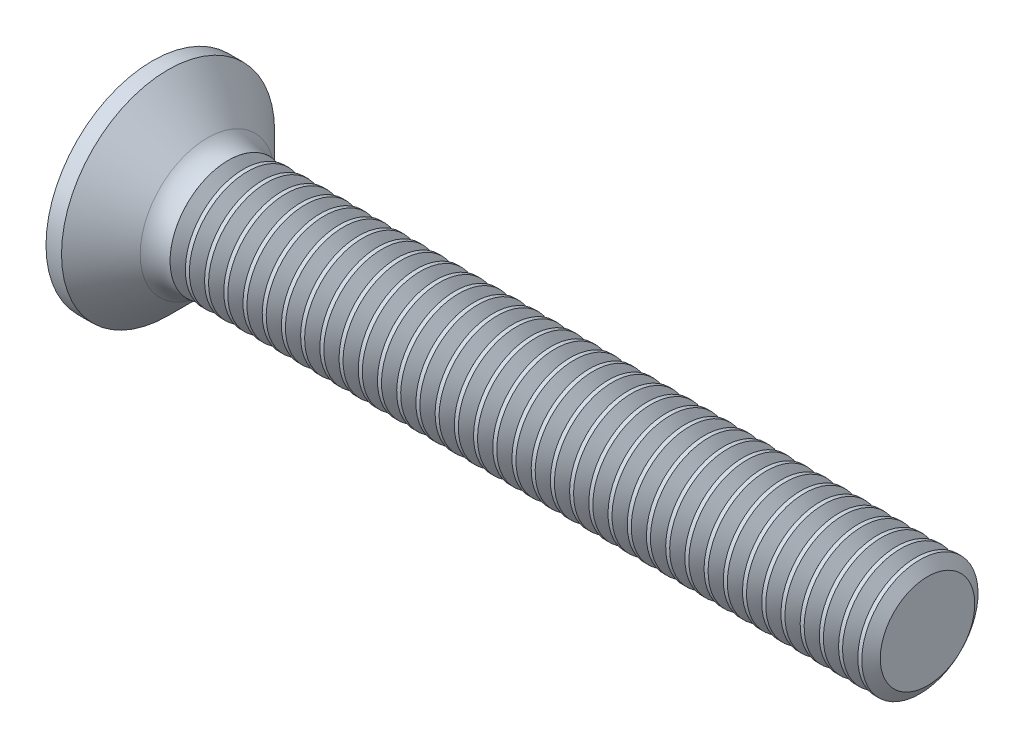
SolidWorks part; units mm, degrees
revolve "Base-Revolve" add sketch "BodySke" angle 360 about L5
sketch "BodySke" plane through (0, 0, 0) normal (0, 0, 1) x (1, 0, 0)
  line L0 (0, 0) -> (0, 2.75)
  line L1 (0, 2.75) -> (0.4, 2.75)
  line L2 (1.65, 1.5) -> (20, 1.5)
  line L3 (20, 1.5) -> (20, 0)
  line L4 (20, 0) -> (0, 0)
  line L5 (-6.35, 0) -> (82.55, 0) construction
  line L6 (1.65, -1.5) -> (20, -1.5) construction
  line L7 (0.4, -2.75) -> (1.65, -1.5) construction
  line L8 (0.4, 2.75) -> (1.65, 1.5)
  line L9 (0, -2.75) -> (0.4, -2.75) construction
  line L10 (2.15, 3.0875) -> (2.15, -6.4375) construction
  line L11 (0, 6.35) -> (0, -3.175) construction
ref_plane "Plane1" through (0, 0, 0) normal (0, 0, 1) x (1, 0, 0)
ref_plane "Plane2" through (0, 0, 0) normal (0, 1, 0) x (1, 0, 0)
ref_plane "Plane3" through (0, 0, 0) normal (1, 0, 0) x (0, 0, -1)
fillet "Fillet1" radius 0.8 1 edges at (1.65, 0, 1.5)
sketch "Sketch3" plane through (0, 0, 0) normal (-1, 0, 0) x (0, 0, 1)
  line L0 (-0.37, 1.5) -> (0.37, 1.5)
  line L1 (0.37, 1.5) -> (0.37, -1.5)
  line L2 (0.37, -1.5) -> (-0.37, -1.5)
  line L3 (-0.37, -1.5) -> (-0.37, 1.5)
ref_plane "Plane4" through (2.01, 0, 0) normal (-1, 0, 0) x (0, 0, 1)
sketch "Sketch4" plane through (2.01, 0, 0) normal (-1, 0, 0) x (0, 0, 1)
  line L0 (-0.37, 0.4979) -> (0.37, 0.4979)
  line L3 (0.37, 0.4979) -> (0.37, -0.4979)
  line L4 (0.37, -0.4979) -> (-0.37, -0.4979)
  line L5 (-0.37, -0.4979) -> (-0.37, 0.4979)
loft "Recess" cut profiles "Sketch3", "Sketch4"
pattern_circular "RecPat" count 2 every 90 about axis through (0, 0, 0) along (1, 0, 0) of "Recess"
sketch "RecCorSke" plane through (0, 0, 0) normal (0, 0, 1) x (1, 0, 0)
  line L0 (-3.175, 0) -> (15.875, 0) construction
  line L2 (0, 0) -> (0, 0.6966)
  line L3 (0, 0.6966) -> (2.01, 0.556)
  line L4 (2.01, 0.556) -> (2.1907, 0)
  line L5 (2.1907, 0) -> (0, 0)
revolve "RecessCore" cut sketch "RecCorSke" angle 360 about L0
sketch "ThdSchSke" plane through (0, 0, 0) normal (0, 0, 1) x (1, 0, 0)
  line L0 (2.15, -1.2195) -> (1.9536, -1.5)
  line L1 (2.15, -1.2195) -> (2.3464, -1.5)
  line L2 (2.3464, -1.5) -> (2.3464, -1.875)
  line L3 (-3.175, 0) -> (5.1513, 0) construction
  line L5 (2.3464, -1.875) -> (1.9536, -1.875)
  line L6 (1.9536, -1.875) -> (1.9536, -1.5)
  line L7 (0, 2.75) -> (0, -2.75) construction
revolve "ThreadSchematic" cut sketch "ThdSchSke" angle 360 about L3
pattern_linear "ThdSchPat" count 37 spacing 0.4958 along (1, 0, 0) of "ThreadSchematic"
equation "\"D1@Sketch3\" = \"Cross_dia@Sketch3\" / 2"
equation "\"D2@Sketch3\" = \"Cross_width@Sketch3\" / 2"
equation "\"Depth@RecCorSke\" = \"Cross_depth@Plane4\""
equation "\"D1@Sketch4\" = \"Cross_width@Sketch3\""
equation "\"D2@Sketch4\" = \"Cross_dia@Sketch3\" - 2.0 * \"Cross_depth@Plane4\" * tan(26.5  * 0.017453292)"
equation "\"D3@Sketch4\" = \"D1@Sketch4\" / 2"
equation "\"D4@Sketch4\" = \"D2@Sketch4\" / 2"
equation "\"Thread_length@ThreadCosmetic\" = ((sgn( (\"Length@BodySke\" - \"Advance@BodySke\" * 1.0 - \"Head_ht@BodySke\" ) - \"Thread_nom@BodySke\" )-1)*( (\"Length@BodySke\" - \"Advance@BodySke\" * 1.0 - \"Head_ht@BodySke\" "
equation "\"Thread_minor@ThdSchSke\" = \"Thread_minor@ThreadCosmetic\""
equation "\"Diameter@ThdSchSke\" = \"Diameter@BodySke\""
equation "\"Overcut@ThdSchSke\" = \"Diameter@BodySke\" * 1.25"
equation "\"Start@ThdSchSke\" = 0.000001 + \"Length@BodySke\" - \"Thread_length@ThreadCosmetic\"  '---Countersunk---"
equation "\"Num_threads@ThdSchPat\" = int( \"Thread_length@ThreadCosmetic\" / \"Advance@BodySke\" + 0.999 )  + 1"
equation "\"Advance@ThdSchPat\" = \"Thread_length@ThreadCosmetic\" /  (\"Num_threads@ThdSchPat\" - 1) 'relax it"
